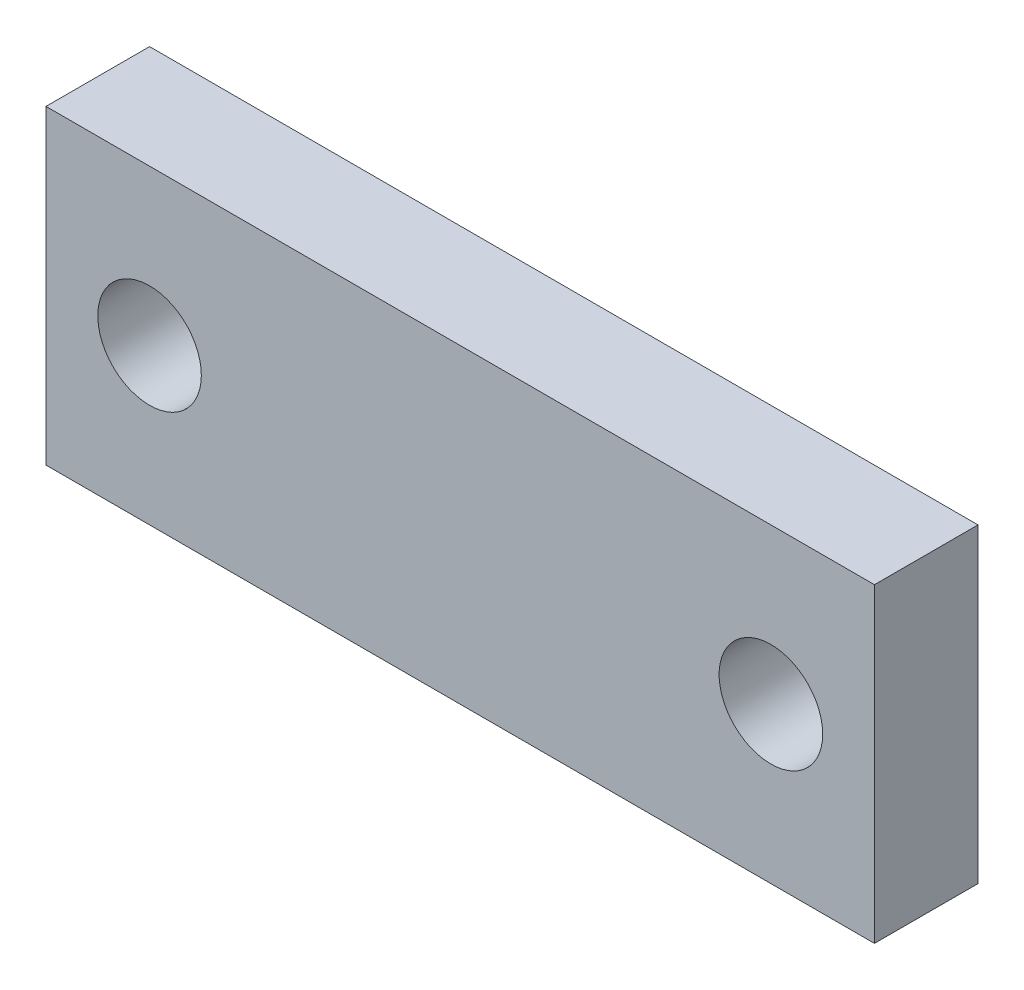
SolidWorks part; units mm, degrees
ref_plane "Ebene vorne" through (0, 0, 0) normal (0, 0, 1) x (1, 0, 0)
ref_plane "Ebene oben" through (0, 0, 0) normal (0, 1, 0) x (1, 0, 0)
ref_plane "Ebene rechts" through (0, 0, 0) normal (1, 0, 0) x (0, 0, -1)
sketch "Skizze1" plane through (0, 0, 0) normal (0, 0, 1) x (1, 0, 0)
  line L1 (-100, 30) -> (-20, 30)
  line L2 (-100, 30) -> (-100, 0)
  line L3 (-100, 0) -> (-20, 0)
  line L4 (-20, 30) -> (-20, 0)
  circle A0 centre (-90, 15) radius 5
  circle A1 centre (-30, 15) radius 5
  dimension "D3" = 10
  dimension "D4" = 10
  dimension "D1" = 30
  dimension "D2" = 15
  dimension "D5" = 10
  dimension "D6" = 60
  dimension "D7" = 15
  dimension "D8" = 10
extrude "Linear austragen1" add sketch "Skizze1" along normal blind 10
